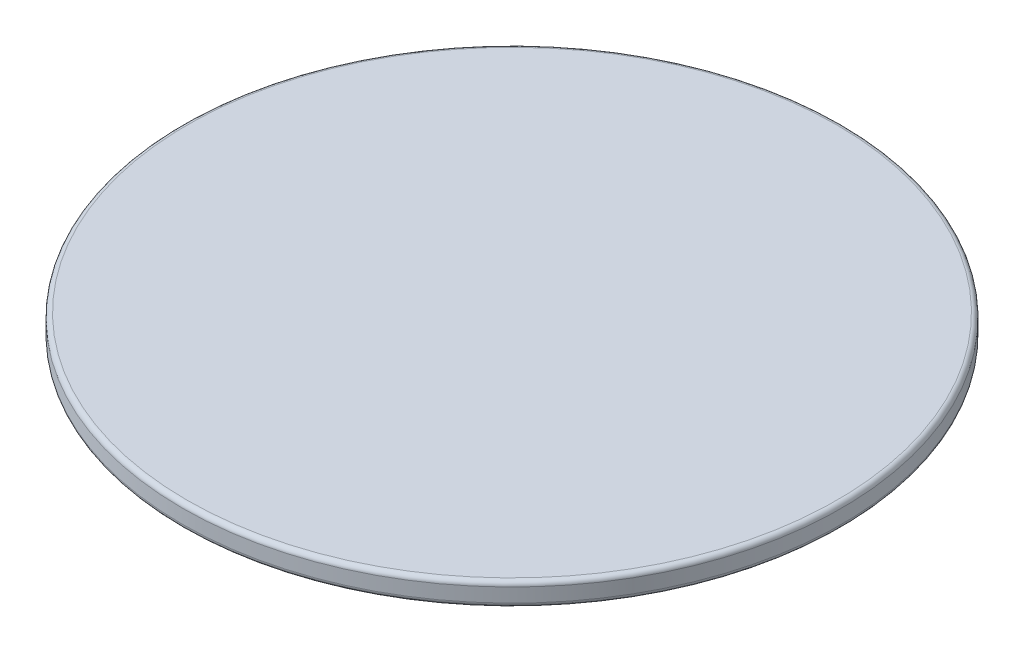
SolidWorks part; units mm, degrees
ref_plane "Front Plane" through (0, 0, 0) normal (0, 0, 1) x (1, 0, 0)
ref_plane "Top Plane" through (0, 0, 0) normal (0, 1, 0) x (1, 0, 0)
ref_plane "Right Plane" through (0, 0, 0) normal (1, 0, 0) x (0, 0, -1)
sketch "Sketch1" plane through (0, 0, 0) normal (0, 0, 1) x (1, 0, 0)
  line L0 (0, 0) -> (0, 47.6475) construction
  line L1 (-59.944, 3.81) -> (-63.754, 3.81)
  line L2 (-59.944, 3.81) -> (-59.944, 7.62)
  line L3 (0, 0) -> (0, 19.05)
  line L4 (-63.754, 12.7) -> (-90.2335, 12.7)
  line L5 (-59.944, 7.62) -> (-63.754, 7.62)
  line L6 (-63.754, 3.81) -> (-63.754, 0)
  line L7 (-63.754, 0) -> (0, 0)
  line L8 (-63.754, 7.62) -> (-63.754, 12.7)
  line L9 (-90.4875, -241.3) -> (-90.4875, 38.1) construction
  line L10 (-90.2335, 12.7) -> (-90.2335, 19.05)
  line L11 (-90.2335, 19.05) -> (0, 19.05)
  line L14 (-63.5, 25.4) -> (-63.5, -0.6863) construction
  dimension "D1" = 3.81
  dimension "D2" = 3.81
  dimension "D3" = 6.35
  dimension "D4" = 12.7
  dimension "D5" = 0.254
  dimension "D6" = 0.254
  dimension "D7" = 3.81
revolve "Revolve1" add sketch "Sketch1" angle 360 about L0
fillet "Fillet1" radius 1.27 3 edges at (0, 0, -63.754) (0, 12.7, -90.2335) (0, 19.05, -90.2335)
